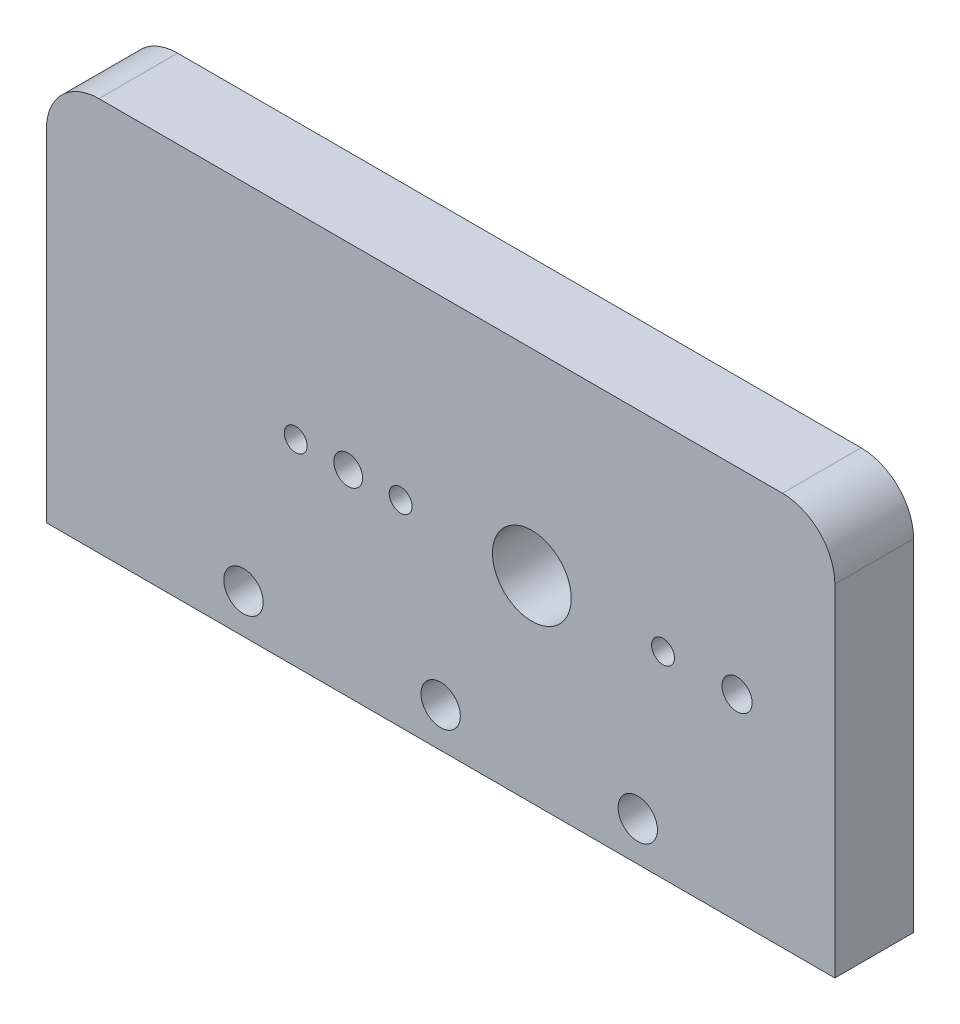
SolidWorks part; units mm, degrees
ref_plane "Front Plane" through (0, 0, 0) normal (0, 0, 1) x (1, 0, 0)
ref_plane "Top Plane" through (0, 0, 0) normal (0, 1, 0) x (1, 0, 0)
ref_plane "Right Plane" through (0, 0, 0) normal (1, 0, 0) x (0, 0, -1)
sketch "Sketch1" plane through (0, 0, 0) normal (0, 0, 1) x (1, 0, 0)
  line L0 (38.0398, -3.9716) -> (38.0398, 22.0284)
  line L1 (34.0398, 26.0284) -> (-18.0578, 26.0284)
  line L2 (7.991, -0.9716) -> (7.991, -3.9716) construction
  line L3 (38.0398, -3.9716) -> (-22.0578, -3.9716)
  line L4 (-22.0578, 22.0284) -> (-22.0578, -3.9716)
  line L5 (-22.0578, -3.9716) -> (-22.0578, 2.0284) construction
  line L6 (-22.0578, 2.0284) -> (38.0398, 2.0284) construction
  line L7 (38.0398, 2.0284) -> (38.0398, -0.9716) construction
  line L8 (7.991, -0.9716) -> (38.0398, -0.9716) construction
  circle A0 centre (14.9422, 11.0284) radius 3
  circle A1 centre (4.9422, 11.0284) radius 0.87
  circle A2 centre (0.9422, 11.0284) radius 1.1
  circle A3 centre (-3.0578, 11.0284) radius 0.87
  circle A4 centre (24.9422, 11.0284) radius 0.87
  circle A5 centre (30.5822, 11.0284) radius 1.15
  circle A6 centre (23.0154, -0.9716) radius 1.5
  circle A7 centre (7.991, -0.9716) radius 1.5
  circle A8 centre (-7.0334, -0.9716) radius 1.5
  arc A9 (38.0398, 22.0284) -> (34.0398, 26.0284) centre (34.0398, 22.0284) ccw
  arc A10 (-22.0578, 22.0284) -> (-18.0578, 26.0284) centre (-18.0578, 22.0284) cw
  dimension "D1" = 4
extrude "Boss-Extrude4" add sketch "Sketch1" along normal blind 6
